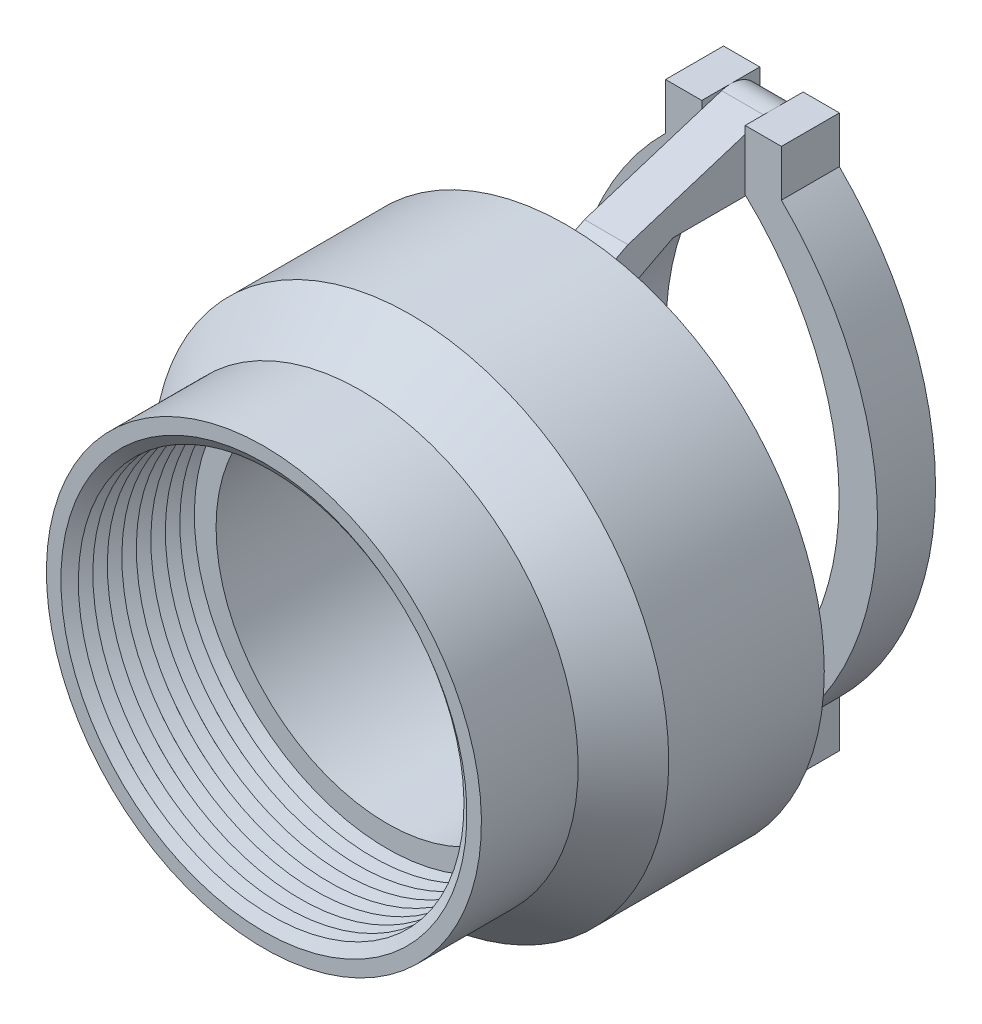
SolidWorks part; units mm, degrees
ref_plane "Front Plane" through (0, 0, 0) normal (0, 0, 1) x (1, 0, 0)
ref_plane "Top Plane" through (0, 0, 0) normal (0, 1, 0) x (1, 0, 0)
ref_plane "Right Plane" through (0, 0, 0) normal (1, 0, 0) x (0, 0, -1)
sketch "Sketch1" plane through (0, 0, 0) normal (1, 0, 0) x (0, 0, -1)
  line L0 (0, 11.8) -> (0, 15)
  line L1 (0, 15) -> (6.67, 15)
  line L2 (6.67, 15) -> (10.1378, 17.78)
  line L3 (10.1378, 17.78) -> (20.8648, 17.78)
  line L4 (20.8648, 17.78) -> (20.8648, 11.8)
  line L5 (20.8648, 11.8) -> (0, 11.8)
  line L6 (0, 0) -> (-39.6271, 0) construction
  dimension "D1" = 35.56
  dimension "D2" = 23.6
  dimension "D3" = 30
  dimension "D4" = 20.8648
revolve "Revolve1" add sketch "Sketch1" angle 360 about L6
sketch "Sketch4" plane through (0, 0, 0) normal (1, 0, 0) x (0, 0, -1)
  line L0 (0, 14.0005) -> (0.5, 13.2965)
  line L1 (0.5, 13.2965) -> (1, 14.0005)
  line L2 (1, 14.0005) -> (1.5, 13.2965)
  line L3 (1.5, 13.2965) -> (2, 14.0005)
  line L4 (2, 14.0005) -> (2.5, 13.2965)
  line L5 (2.5, 13.2965) -> (3, 14.0005)
  line L6 (3, 14.0005) -> (3.5, 13.2965)
  line L7 (3.5, 13.2965) -> (4, 14.0005)
  line L8 (0, 15) -> (0, -15) construction
  line L9 (0, 0) -> (-7.669, 0) construction
  line L10 (4, 14.0005) -> (4.5, 13.2965)
  line L11 (4.5, 13.2965) -> (5, 14.0005)
  line L12 (5, 14.0005) -> (5.5, 13.2965)
  line L13 (5.5, 13.2965) -> (6, 14.0005)
  line L14 (6, 14.0005) -> (6.5, 13.2965)
  line L15 (6.5, 13.2965) -> (7, 14.0005)
  line L16 (7, 14.0005) -> (7.5, 13.2965)
  line L17 (7.5, 13.2965) -> (8, 14.0005)
  line L18 (8, 14.0005) -> (8.5, 13.2965)
  line L20 (8.5, 10.9729) -> (0, 10.9729)
  line L21 (0, 10.9729) -> (0, 14.0005)
  line L22 (8.5, 13.2965) -> (8.5, 10.9729)
  dimension "D1" = 28.001
  dimension "D2" = 0.704
  dimension "D3" = 1
revolve "M28 x 1.0 (ISO ??)" cut sketch "Sketch4" angle 360 about L9
sketch "Sketch2" plane through (0, 0, 0) normal (1, 0, 0) x (0, 0, -1)
  line L0 (0, 0) -> (15.6763, 0) construction
  line L1 (20.8648, 11.8) -> (26.7148, 14.8322)
  line L2 (20.8648, -11.8) -> (26.7148, -14.8322)
  line L3 (26.7148, 14.8322) -> (33.6911, 14.8322)
  line L4 (26.7148, -14.8322) -> (33.6911, -14.8322)
  line L5 (33.0571, 18.9525) -> (23.6077, 15.974)
  line L6 (33.0571, -18.9525) -> (23.6077, -15.974)
  line L7 (23.6077, 15.974) -> (20.8648, 14.5523)
  line L8 (20.8648, -17.78) -> (20.8648, 17.78) construction
  line L9 (23.6077, -15.974) -> (20.8648, -14.5523)
  line L10 (20.8648, 14.5523) -> (20.8648, 11.8)
  line L11 (20.8648, -14.5523) -> (20.8648, -11.8)
  line L12 (0, 15) -> (0, -15) construction
  arc A0 (33.0571, 18.9525) -> (33.6911, 14.8322) centre (33.6911, 16.9411) cw
  arc A1 (33.0571, -18.9525) -> (33.6911, -14.8322) centre (33.6911, -16.9411) ccw
  dimension "D2" = 38.1
  dimension "D3" = 2.1089
  dimension "D1" = 35.8
  dimension "D4" = 2.7523
extrude "Boss-Extrude1" add sketch "Sketch2" along normal mid plane 3
ref_plane "Plane1" through (0, 0, -33.6911) normal (0, 0, 1) x (1, 0, 0)
sketch "Sketch3" plane through (0, 0, -33.6911) normal (0, 0, 1) x (1, 0, 0)
  line L0 (0, 0) -> (-7.7891, 0) construction
  line L1 (-1.4949, 19.05) -> (-1.4949, 14.9129)
  line L2 (1.5, 19.05) -> (-1.5, 19.05) construction
  line L3 (-1.4949, -19.05) -> (-1.4949, -14.9129)
  line L4 (-3.9949, 19.05) -> (-3.9949, 15.8378)
  line L5 (-3.9949, 19.05) -> (-3.9949, 15.9623) construction
  line L6 (-3.9949, -15.8378) -> (-3.9949, -19.05)
  line L7 (-1.4949, -19.05) -> (-3.9949, -19.05)
  line L8 (-1.4949, 19.05) -> (-3.9949, 19.05)
  arc A0 (-1.4949, 14.9129) -> (-1.4949, -14.9129) centre (12.425, 0) ccw
  arc A2 (-3.9949, 15.8378) -> (-3.9949, -15.8378) centre (11.601, 0) ccw
  arc A3 (-3.9949, 15.9623) -> (-3.2008, -16.7405) centre (12.425, 0) ccw construction
  dimension "D2" = 20.4
  dimension "D4" = 22.2276
  dimension "D3" = 4.1371
  dimension "D5" = 2.5
  dimension "D6" = 3.2122
  dimension "D1" = 2.5
extrude "Boss-Extrude2" add sketch "Sketch3" along normal mid plane 4
mirror "Mirror1" about plane through (0, 0, 0) normal (1, 0, 0) of "Boss-Extrude2"
equation "\"Buoyancy\"=\"SW-Volume\"*(\"SW-Density\"-.037062)"
